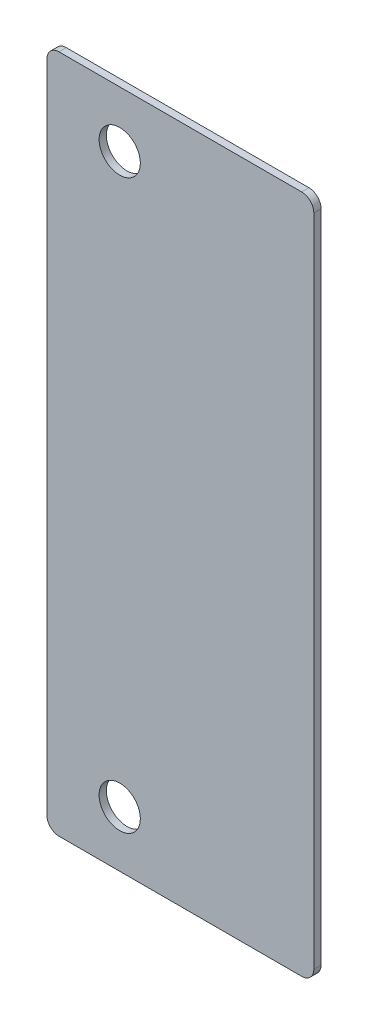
SolidWorks part; units mm, degrees
ref_plane "Plan de face" through (0, 0, 0) normal (0, 0, 1) x (1, 0, 0)
ref_plane "Plan de dessus" through (0, 0, 0) normal (0, 1, 0) x (1, 0, 0)
ref_plane "Plan de droite" through (0, 0, 0) normal (1, 0, 0) x (0, 0, -1)
sketch "Esquisse1" plane through (0, 0, 0) normal (0, 0, 1) x (1, 0, 0)
  line L1 (2.5, 0) -> (52.5, 0)
  line L2 (0, 2.5) -> (0, 137.5)
  line L3 (2.5, 140) -> (52.5, 140)
  line L4 (55, 2.5) -> (55, 137.5)
  circle A0 centre (15, 128.5) radius 4.25
  circle A1 centre (15, 11.5) radius 4.25
  arc A2 (0, 137.5) -> (2.5, 140) centre (2.5, 137.5) cw
  arc A3 (52.5, 140) -> (55, 137.5) centre (52.5, 137.5) cw
  arc A4 (52.5, 0) -> (55, 2.5) centre (52.5, 2.5) ccw
  arc A5 (2.5, 0) -> (0, 2.5) centre (2.5, 2.5) cw
  point P10 (0, 140)
  point P13 (55, 140)
  point P18 (0, 0)
  dimension "D3" = 8.5
  dimension "D4" = 11.5
  dimension "D5" = 117
  dimension "D6" = 15
  dimension "D7" = 2.5
  dimension "D1" = 55
  dimension "D2" = 140
extrude "Extrusion1" add sketch "Esquisse1" along normal blind 1.5
